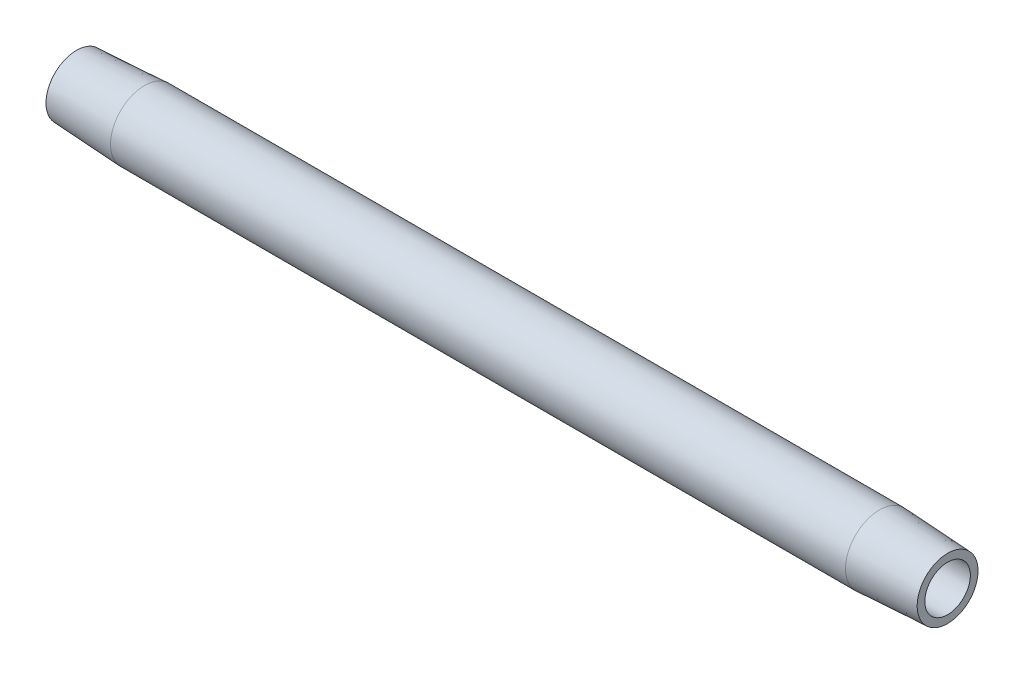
SolidWorks part; units mm, degrees
ref_plane "Front Plane" through (0, 0, 0) normal (0, 0, 1) x (1, 0, 0)
ref_plane "Top Plane" through (0, 0, 0) normal (0, 1, 0) x (1, 0, 0)
ref_plane "Right Plane" through (0, 0, 0) normal (1, 0, 0) x (0, 0, -1)
sketch "Sketch2" plane through (0, 0, 0) normal (0, 0, 1) x (1, 0, 0)
  line L0 (0.4761, 0) -> (50000.4761, 0) construction
  line L1 (0, -11.3625) -> (0, 49988.6375) construction
  line L7 (7.9375, 3.9687) -> (0, 3.5528)
  line L8 (93.6625, 3.9688) -> (7.9375, 3.9687)
  line L9 (101.6, 3.5528) -> (93.6625, 3.9688)
  line L10 (101.6, 2.6543) -> (101.6, 3.5528)
  line L11 (101.6, 2.6543) -> (0, 2.6543)
  line L12 (0, 3.5528) -> (0, 2.6543)
  dimension "D1" = 5.3086
  dimension "D2" = 7.9375
  dimension "D3" = 3
  dimension "D4" = 3
  dimension "D5" = 7.9375
  dimension "D6" = 7.9375
  dimension "D7" = 101.6
revolve "Revolve1" add sketch "Sketch2" angle 360 about L0
